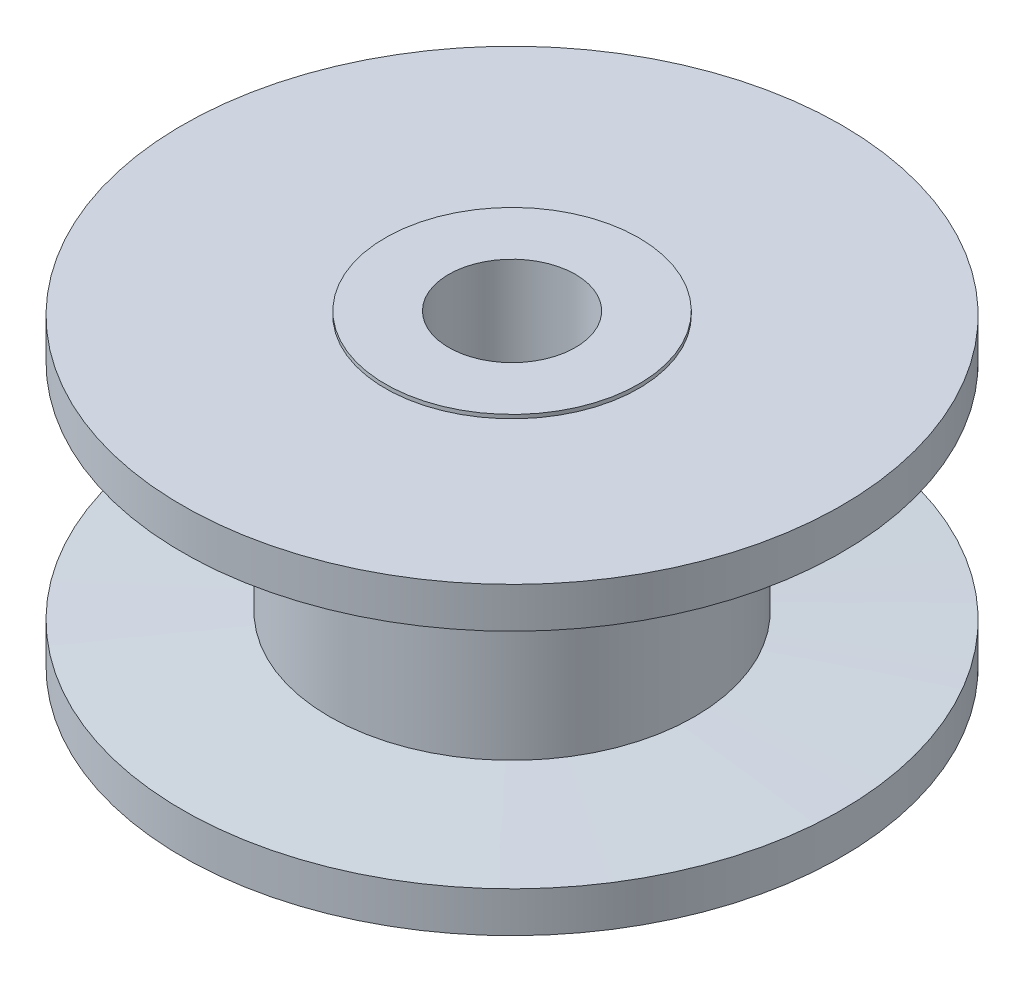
SolidWorks part; units mm, degrees
ref_plane "Plan de face" through (0, 0, 0) normal (0, 0, 1) x (1, 0, 0)
ref_plane "Plan de dessus" through (0, 0, 0) normal (0, 1, 0) x (1, 0, 0)
ref_plane "Plan de droite" through (0, 0, 0) normal (1, 0, 0) x (0, 0, -1)
sketch "Esquisse1" plane through (0, 0, 0) normal (0, 0, 1) x (1, 0, 0)
  line L0 (0, 0) -> (0, 79.0295) construction
  line L1 (12.5, 0) -> (12.5, 61.5)
  line L2 (12.5, 61.5) -> (25, 61.5)
  line L3 (25, 61.5) -> (25, 60.75)
  line L4 (25, 60.75) -> (65, 60.75)
  line L5 (65, 60.75) -> (65, 52.75)
  line L6 (65, 52.75) -> (36, 51.3)
  line L7 (36, 51.3) -> (36, 10.19)
  line L8 (36, 10.19) -> (65, 8.75)
  line L9 (65, 8.75) -> (65, 0.75)
  line L10 (65, 0.75) -> (25, 0.75)
  line L11 (25, 0.75) -> (25, 0)
  line L12 (25, 0) -> (12.5, 0)
  dimension "D1" = 25
  dimension "D2" = 50
  dimension "D3" = 130
  dimension "D4" = 72
  dimension "D5" = 61.5
  dimension "D6" = 41.11
  dimension "D7" = 44
  dimension "D8" = 0.75
  dimension "D9" = 10.19
  dimension "D10" = 8.75
  dimension "D11" = 60
revolve "Révolution1" add sketch "Esquisse1" angle 360 about L0
ref_plane "Plan1" through (0, 30.75, 0) normal (0, 1, 0) x (-1, 0, 0)
